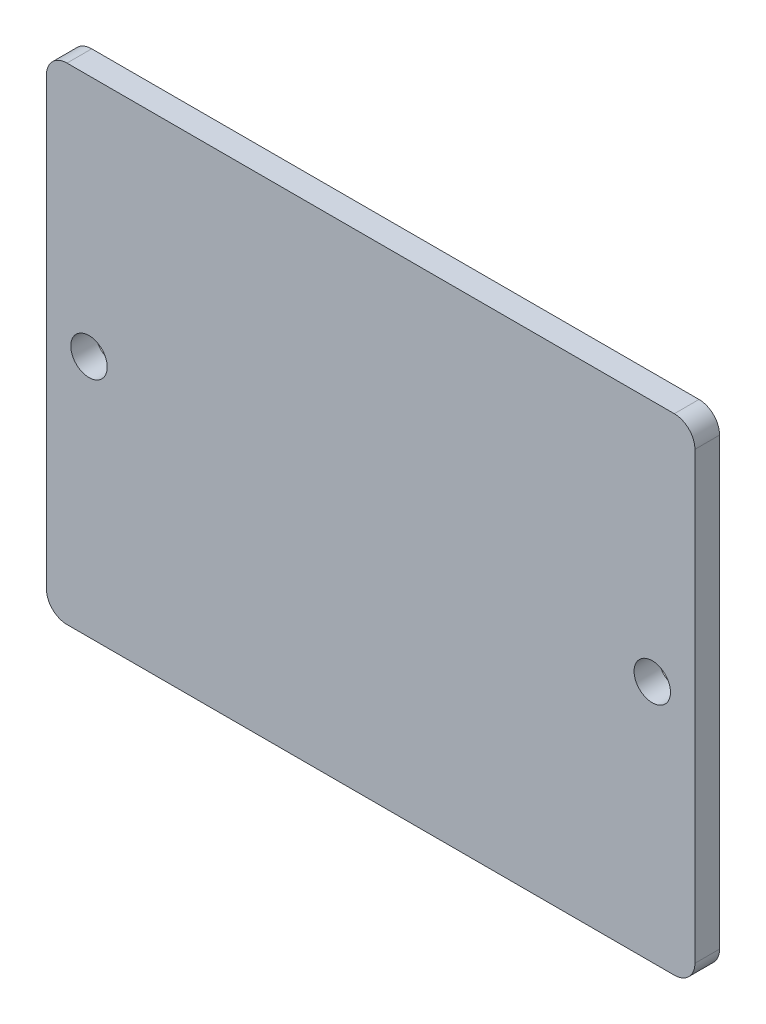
SolidWorks part; units mm, degrees
ref_plane "Front" through (0, 0, 0) normal (0, 0, 1) x (1, 0, 0)
ref_plane "Top" through (0, 0, 0) normal (0, 1, 0) x (1, 0, 0)
ref_plane "Right" through (0, 0, 0) normal (1, 0, 0) x (0, 0, -1)
sketch "Sketch1" plane through (0, 0, 0) normal (0, 0, 1) x (1, 0, 0)
  line L0 (-37.465, -27.4574) -> (37.465, 27.4574) construction
  line L1 (-37.465, 29.9974) -> (37.465, 29.9974)
  line L2 (-40.005, 27.4574) -> (-40.005, -27.4574)
  line L3 (-37.465, -29.9974) -> (37.465, -29.9974)
  line L4 (40.005, 27.4574) -> (40.005, -27.4574)
  arc A0 (-40.005, 27.4574) -> (-37.465, 29.9974) centre (-37.465, 27.4574) cw
  arc A1 (40.005, 27.4574) -> (37.465, 29.9974) centre (37.465, 27.4574) ccw
  arc A2 (37.465, -29.9974) -> (40.005, -27.4574) centre (37.465, -27.4574) ccw
  arc A3 (-40.005, -27.4574) -> (-37.465, -29.9974) centre (-37.465, -27.4574) ccw
  point P6 (-40.005, 29.9974)
  point P12 (40.005, -29.9974)
  dimension "D3" = 2.54
  dimension "D1" = 59.9948
  dimension "D2" = 80.01
extrude "Base-Extrude" add sketch "Sketch1" along normal blind 3.048
sketch "Sketch2" plane through (0, 0, 3.048) normal (0, 0, 1) x (1, 0, 0)
  line L0 (-42.4859, 0) -> (42.2921, 0) construction
  line L1 (0, 33.2814) -> (0, -31.4405) construction
  circle A0 centre (-34.7472, 0) radius 2.2479
  circle A1 centre (34.7472, 0) radius 2.2479
  dimension "D1" = 4.4958
  dimension "D2" = 69.4944
extrude "Cut-Extrude1" cut sketch "Sketch2" against normal up to next
